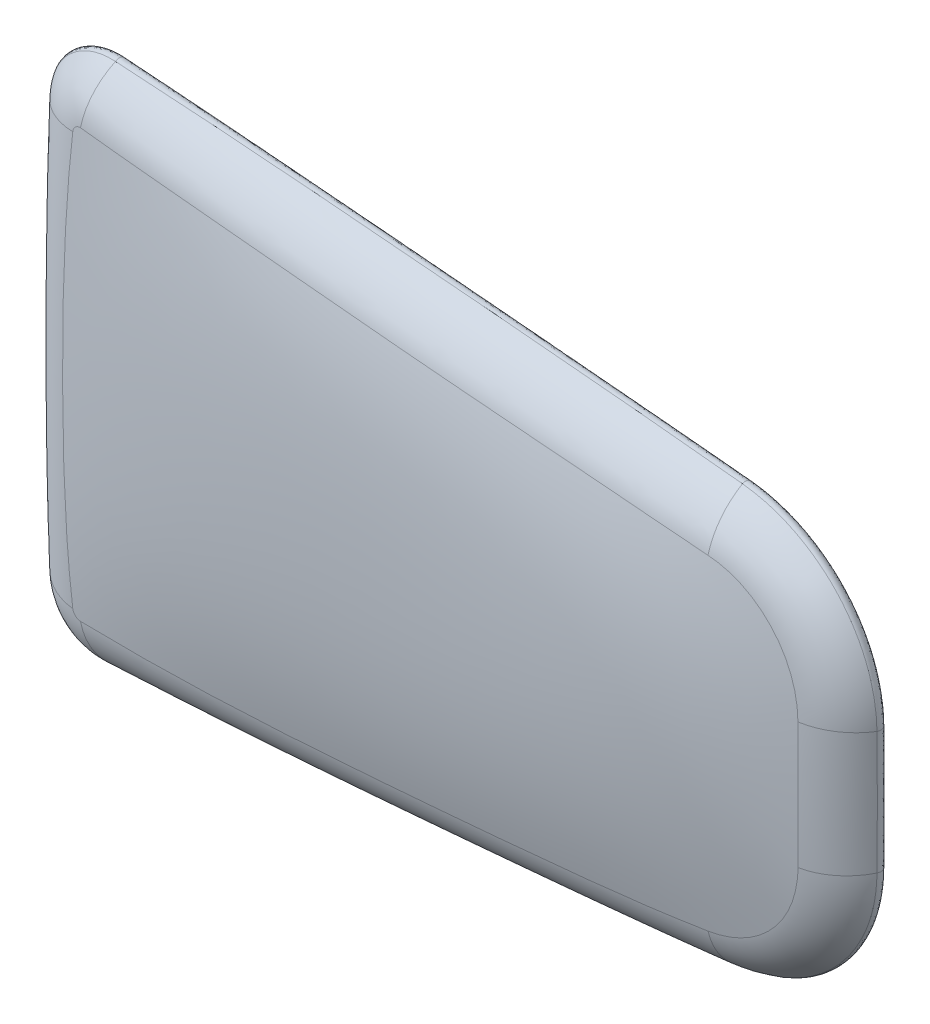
SolidWorks part; units mm, degrees
ref_plane "Front Plane" through (0, 0, 0) normal (0, 0, 1) x (1, 0, 0)
ref_plane "Top Plane" through (0, 0, 0) normal (0, 1, 0) x (1, 0, 0)
ref_plane "Right Plane" through (0, 0, 0) normal (1, 0, 0) x (0, 0, -1)
sketch "Sketch1" plane through (0, 0, 0) normal (0, 0, 1) x (1, 0, 0)
  line L0 (615, 0) -> (-15, 0) construction
  line L12 (-15, -206.3696) -> (510.0229, -160.4361)
  line L13 (615, -45.8737) -> (615, 45.8737)
  line L14 (510.0229, 160.4361) -> (-15, 206.3696)
  line L15 (-15, 206.3696) -> (-15, -206.3696)
  arc A6 (510.0229, -160.4361) -> (615, -45.8737) centre (500, -45.8737) ccw
  arc A7 (615, 45.8737) -> (510.0229, 160.4361) centre (500, 45.8737) ccw
  dimension "D3" = 115
  dimension "D1" = 630
  dimension "D2" = 412.7393
  dimension "D4" = 15
  dimension "D5" = 5
extrude "Boss-Extrude1" add sketch "Sketch1" along normal blind 25
fillet "Fillet1" radius 50 2 edges at (-15, -206.3696, 12.5) (-15, 206.3696, 12.5)
other "Freeform1"
fillet "Fillet2" radius 50 8 edges
fillet "Fillet3" radius 5 8 edges at (274.6903, -181.025, 0) (1.2205, -188.6681, 0) (-15, 0, 0) (1.2205, 188.6681, 0) (274.6903, 181.025, 0) (584.7869, 123.5666, 0) (615, 0, 0) (584.7869, -123.5666, 0)
